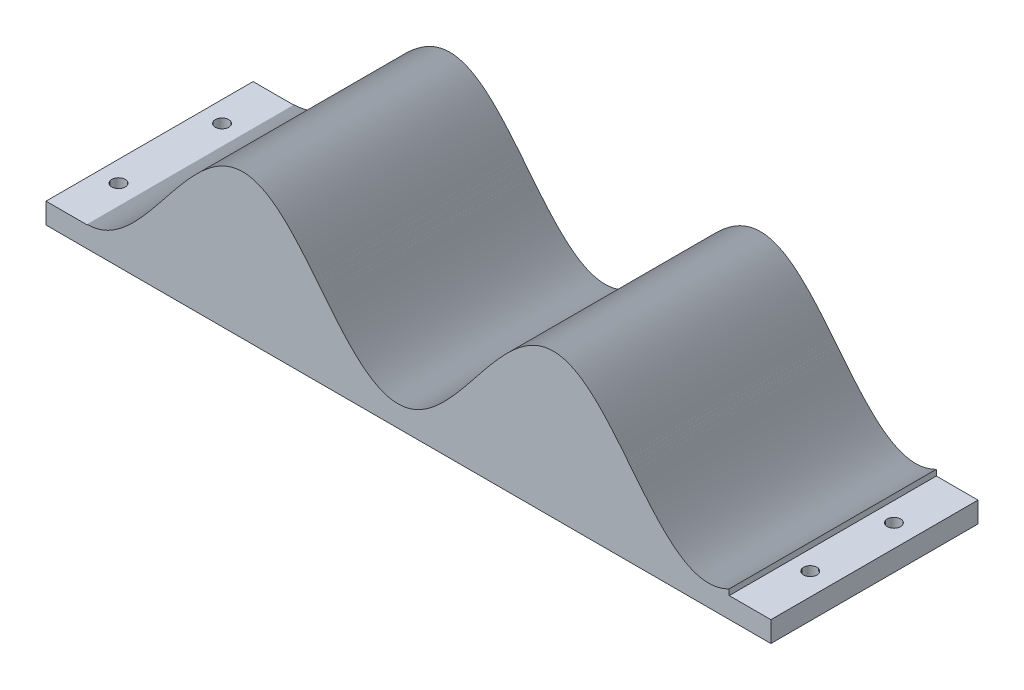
SolidWorks part; units mm, degrees
ref_plane "Front Plane" through (0, 0, 0) normal (0, 0, 1) x (1, 0, 0)
ref_plane "Top Plane" through (0, 0, 0) normal (0, 1, 0) x (1, 0, 0)
ref_plane "Right Plane" through (0, 0, 0) normal (1, 0, 0) x (0, 0, -1)
sketch "Model"
  dimension "D2" = 20
  dimension "D3" = 10
  dimension "D4" = 350
extrude "Boss-Extrude1" add sketch "Model" along normal blind 100
sketch "Sketch2" plane through (0, -10, 0) normal (0, -1, 0) x (1, 0, 0)
  line L0 (-20, 50) -> (330, 50) construction
  line L1 (-20, 100) -> (-20, 0) construction
  line L2 (330, 100) -> (330, 0) construction
  line L3 (155, 100) -> (153.5444, 0) construction
  line L4 (-20, 100) -> (330, 100) construction
  circle A0 centre (-10, 75) radius 3.25
  circle A1 centre (319.2025, 70.2081) radius 3.25
  circle A2 centre (319.2025, 29.7919) radius 3.25
  circle A3 centre (-10, 25) radius 3.25
  dimension "D1" = 6.5
  dimension "D2" = 25
  dimension "D3" = 10
extrude "Cut-Extrude1" cut sketch "Sketch2" against normal through all both and the other way through all
